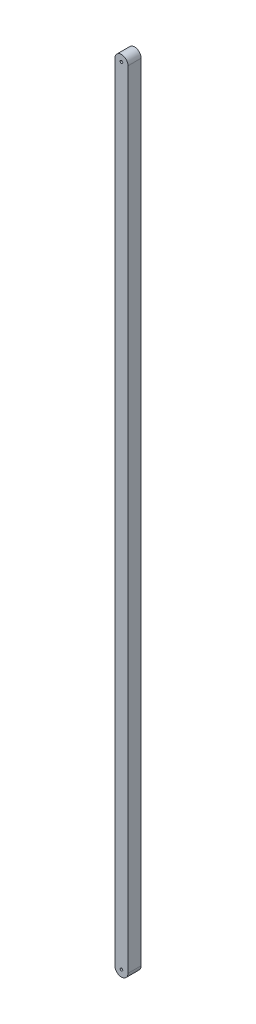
SolidWorks part; units mm, degrees
ref_plane "Front Plane" through (0, 0, 0) normal (0, 0, 1) x (1, 0, 0)
ref_plane "Top Plane" through (0, 0, 0) normal (0, 1, 0) x (1, 0, 0)
ref_plane "Right Plane" through (0, 0, 0) normal (1, 0, 0) x (0, 0, -1)
sketch "Sketch3" plane through (0, 0, 0) normal (0, 0, 1) x (1, 0, 0)
  line L0 (-0.5, 30) -> (0.5, -30) construction
  line L2 (-0.5, 30) -> (-0.5, -30)
  line L4 (0.5, 30) -> (0.5, -30)
  arc A0 (-0.5, 30) -> (0.5, 30) centre (0, 30) cw
  arc A1 (-0.5, -30) -> (0.5, -30) centre (0, -30) ccw
  circle A2 centre (0, 30) radius 0.1
  circle A3 centre (0, -30) radius 0.1
  dimension "D2" = 0.5
  dimension "D3" = 0.2
  dimension "D1" = 60
extrude "Extrude1" add sketch "Sketch3" along normal mid plane 1
